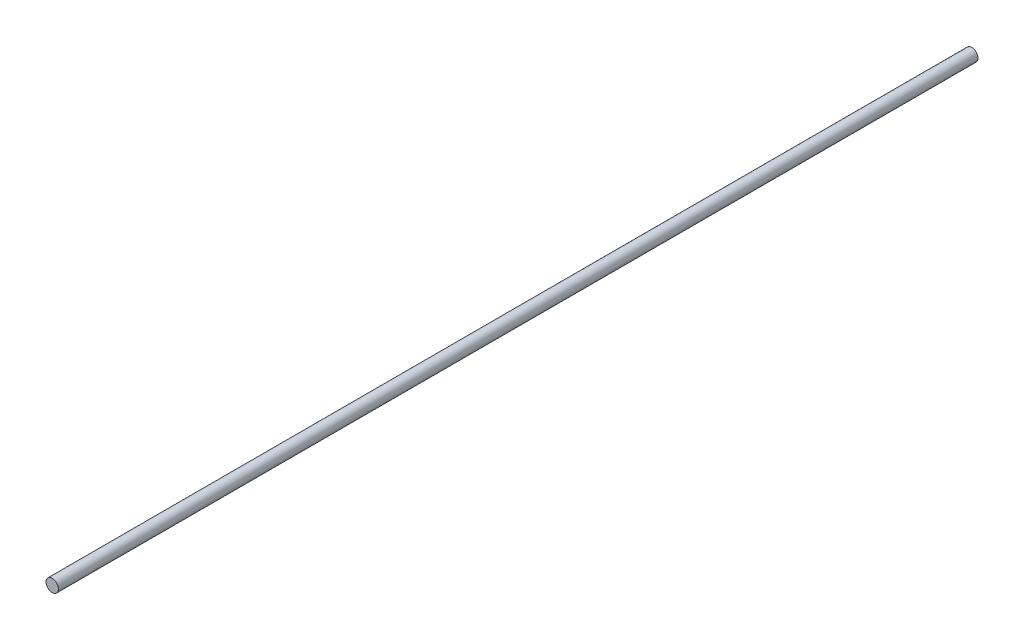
SolidWorks part; units mm, degrees
ref_plane "Front Plane" through (0, 0, 0) normal (0, 0, 1) x (1, 0, 0)
ref_plane "Top Plane" through (0, 0, 0) normal (0, 1, 0) x (1, 0, 0)
ref_plane "Right Plane" through (0, 0, 0) normal (1, 0, 0) x (0, 0, -1)
sketch "Sketch1" plane through (0, 0, 0) normal (0, 0, 1) x (1, 0, 0)
  circle A0 centre (0, 0) radius 30
  dimension "D1" = 60
extrude "Boss-Extrude1" add sketch "Sketch1" against normal blind 4450
